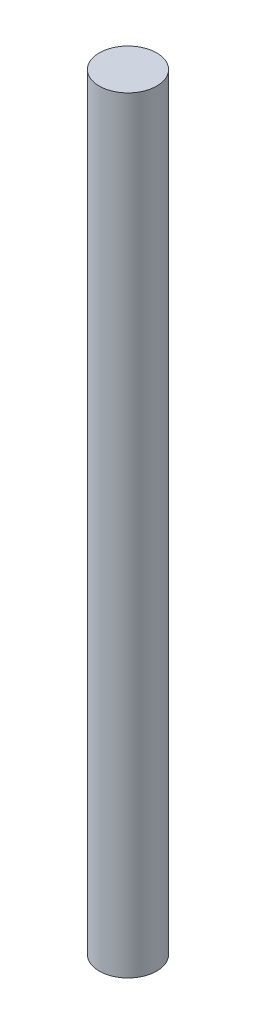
SolidWorks part; units mm, degrees
ref_plane "Plan de face" through (0, 0, 0) normal (0, 0, 1) x (1, 0, 0)
ref_plane "Plan de dessus" through (0, 0, 0) normal (0, 1, 0) x (1, 0, 0)
ref_plane "Plan de droite" through (0, 0, 0) normal (1, 0, 0) x (0, 0, -1)
sketch "Esquisse1" plane through (0, 0, 0) normal (0, 1, 0) x (1, 0, 0)
  circle A0 centre (0, 0) radius 3
  dimension "D1" = 6
extrude "Extrusion1" add sketch "Esquisse1" along normal blind 80
